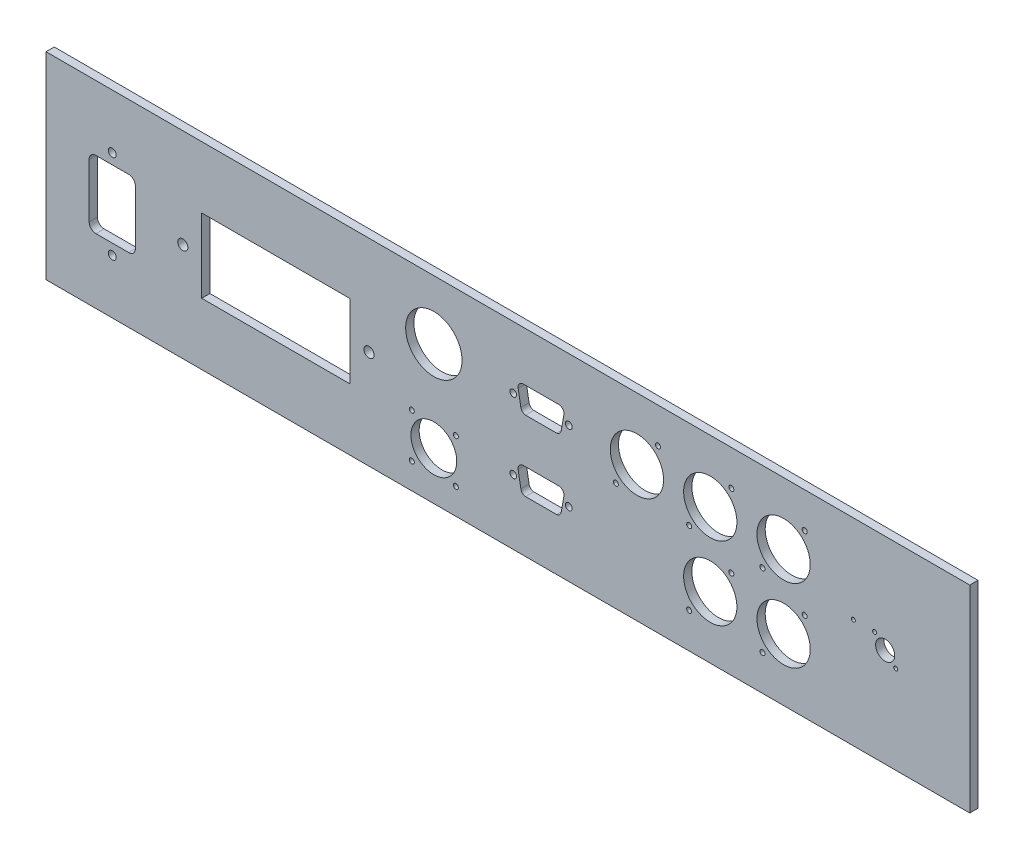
SolidWorks part; units mm, degrees
ref_plane "Front Plane" through (0, 0, 0) normal (0, 0, 1) x (1, 0, 0)
ref_plane "Top Plane" through (0, 0, 0) normal (0, 1, 0) x (1, 0, 0)
ref_plane "Right Plane" through (0, 0, 0) normal (1, 0, 0) x (0, 0, -1)
sketch "Sketch1" plane through (0, 0, 0) normal (0, 0, 1) x (1, 0, 0)
  line L1 (-207.9625, 44.45) -> (207.9625, 44.45)
  line L2 (-207.9625, 44.45) -> (-207.9625, -44.45)
  line L3 (-207.9625, -44.45) -> (207.9625, -44.45)
  line L4 (207.9625, 44.45) -> (207.9625, -44.45)
  line L5 (-207.9625, 44.45) -> (207.9625, -44.45) construction
  line L6 (-207.9625, -44.45) -> (207.9625, 44.45) construction
  point P0 (0, 0)
  dimension "D1" = 88.9
  dimension "D2" = 415.925
extrude "Boss-Extrude1" add sketch "Sketch1" along normal blind 3.7084
sketch "Sketch2" plane through (0, 0, 0) normal (0, 0, -1) x (-1, 0, 0)
  line L0 (-207.9625, 0) -> (207.2005, 0) construction
  line L1 (-207.9625, -44.45) -> (-207.9625, 44.45) construction
  line L2 (207.2005, 44.45) -> (207.2005, -44.45) construction
  circle A0 centre (-169.8625, 0) radius 4.3053
  dimension "D1" = 8.6106
  dimension "D2" = 38.1
extrude "Cut-Extrude1" cut sketch "Sketch2" against normal through all
hole_wizard "#2-56 Tapped Hole1" positions "Sketch3" profile "Sketch4" tap size "#2-56" standard "ANSI Inch"
sketch "Sketch3" plane through (0, 0, 0) normal (0, 0, -1) x (-1, 0, 0)
  line L0 (207.9625, -44.45) -> (-207.9625, -44.45) construction
  point P0 (-174.6123, -4.7498)
  point P3 (-165.1125, 4.75)
  point P7 (-155.5875, 4.75)
  dimension "D1" = 9.525
  dimension "D2" = 49.2
sketch "Sketch4" plane through (174.6123, -4.7498, 0) normal (1, 0, 0) x (0, 1, 0)
  line L0 (0, 0) -> (0, 3.7084)
  line L1 (0, 3.7084) -> (0.889, 3.7084)
  line L2 (0.889, 3.7084) -> (0.889, 0)
  line L5 (0.889, 0) -> (0, 0)
  line L11 (0, -6.35) -> (0, 107.95) construction
  dimension "Thru Tap Drill Dia." = 1.778
  dimension "Thru Tap Drill Depth" = 3.7084
sketch "Sketch5" plane through (0, 0, 0) normal (0, 0, -1) x (-1, 0, 0)
  line L0 (-207.9625, 0) -> (207.9625, 0) construction
  line L1 (-207.9625, -44.45) -> (-207.9625, 44.45) construction
  line L2 (207.9625, 44.45) -> (207.9625, -44.45) construction
  line L3 (207.9625, -44.45) -> (-207.9625, -44.45) construction
  circle A0 centre (-124.1425, 16.51) radius 12
  dimension "D1" = 24
  dimension "D2" = 83.82
  dimension "D3" = 60.96
extrude "Cut-Extrude2" cut sketch "Sketch5" against normal through all
hole_wizard "#4-40 Tapped Hole1" positions "Sketch6" profile "Sketch7" tap size "#4-40" standard "ANSI Inch"
sketch "Sketch6" plane through (0, 0, 0) normal (0, 0, -1) x (-1, 0, 0)
  line L2 (-124.1425, 28.51) -> (-124.1425, 4.51) construction
  line L4 (-136.1425, 16.51) -> (-112.1425, 16.51) construction
  circle A0 centre (-124.1425, 16.51) radius 12 construction
  point P0 (-133.6425, 28.51)
  point P2 (-114.6425, 4.51)
  dimension "D1" = 9.5
  dimension "D2" = 12
  dimension "D3" = 12
  dimension "D4" = 9.5
sketch "Sketch7" plane through (133.6425, 28.51, 0) normal (1, 0, 0) x (0, 1, 0)
  line L0 (0, 0) -> (0, 3.7084)
  line L1 (0, 3.7084) -> (1.1303, 3.7084)
  line L2 (1.1303, 3.7084) -> (1.1303, 0)
  line L5 (1.1303, 0) -> (0, 0)
  line L11 (0, -6.35) -> (0, 107.95) construction
  dimension "Thru Tap Drill Dia." = 2.2606
  dimension "Thru Tap Drill Depth" = 3.7084
pattern_linear "LPattern2" count 2 spacing 33.02 along (0, -1, 0) count 3 spacing 33.02 along (-1, 0, 0) of "Cut-Extrude2", "#4-40 Tapped Hole1"
sketch "Sketch10" plane through (0, 0, 0) normal (0, 0, -1) x (-1, 0, 0)
  line L0 (-14.9225, 23.4991) -> (-14.9225, 9.7875) construction
  line L1 (-6.7326, 22.3272) -> (-23.1124, 22.3272)
  line L2 (-7.9125, 10.6916) -> (-21.9325, 10.6916)
  line L3 (-25.224, 19.5371) -> (-24.0101, 12.6528)
  line L4 (-4.621, 19.5371) -> (-5.8349, 12.6528)
  line L5 (-25.2603, 19.9517) -> (-25.2603, 9.8357) construction
  line L7 (-14.9225, 27.6584) -> (-14.9225, -4.1962) construction
  line L8 (-207.9625, -44.45) -> (-207.9625, 44.45) construction
  line L9 (-58.1025, 16.51) -> (51.5802, 16.51) construction
  arc A0 (-23.1124, 22.3272) -> (-25.224, 19.5371) centre (-22.8727, 19.9517) ccw
  arc A1 (-24.0101, 12.6528) -> (-21.9325, 10.6916) centre (-21.6535, 13.0683) ccw
  circle A2 centre (-27.4193, 16.51) radius 1.524
  arc A3 (-5.8349, 12.6528) -> (-7.9125, 10.6916) centre (-8.1915, 13.0683) cw
  circle A4 centre (-2.4257, 16.51) radius 1.524
  arc A5 (-6.7326, 22.3272) -> (-4.621, 19.5371) centre (-6.9723, 19.9517) cw
  point P9 (-14.9225, 10.6916)
  point P19 (-14.9225, 22.3272)
  dimension "D5" = 3.048
  dimension "D6" = 2.3876
  dimension "D4" = 10
  dimension "D1" = 7.9502
  dimension "D2" = 6.731
  dimension "D3" = 12.4968
  dimension "D7" = 3.4417
  dimension "D8" = 193.04
  dimension "D9" = 3.4417
  dimension "D10" = 11.6356
  dimension "D11" = 5.8172
extrude "Cut-Extrude3" cut sketch "Sketch10" against normal through all and the other way through all
pattern_linear "LPattern3" count 2 spacing 31.75 along (0, -1, 0) of "Cut-Extrude3"
sketch "Sketch11" plane through (0, 0, 0) normal (0, 0, -1) x (-1, 0, 0)
  line L0 (207.9625, 0) -> (-207.9625, 0) construction
  line L1 (207.9625, 44.45) -> (207.9625, -44.45) construction
  line L2 (-207.9625, -44.45) -> (-207.9625, 44.45) construction
  line L3 (207.9625, -44.45) -> (-207.9625, -44.45) construction
  circle A0 centre (33.3375, 17.78) radius 12.7
  dimension "D1" = 241.3
  dimension "D2" = 62.23
extrude "Cut-Extrude4" cut sketch "Sketch11" against normal through all
sketch "Sketch12" plane through (0, 0, 0) normal (0, 0, -1) x (-1, 0, 0)
  line L0 (207.9625, 0) -> (-207.9625, 0) construction
  line L1 (207.9625, 44.45) -> (207.9625, -44.45) construction
  line L2 (-207.9625, -44.45) -> (-207.9625, 44.45) construction
  line L3 (207.9625, -44.45) -> (-207.9625, -44.45) construction
  circle A0 centre (33.3375, -22.86) radius 10.3251
  dimension "D1" = 20.6502
  dimension "D2" = 241.3
  dimension "D3" = 21.59
extrude "Cut-Extrude5" cut sketch "Sketch12" against normal through all
hole_wizard "#4-40 Tapped Hole2" positions "Sketch13" profile "Sketch14" tap size "#4-40" standard "ANSI Inch"
sketch "Sketch13" plane through (0, 0, 0) normal (0, 0, -1) x (-1, 0, 0)
  line L0 (23.4188, -12.9413) -> (43.2562, -12.9413) construction
  line L1 (43.2562, -12.9413) -> (43.2562, -32.7787) construction
  line L2 (43.2562, -32.7787) -> (23.4188, -32.7787) construction
  line L3 (23.4188, -32.7787) -> (23.4188, -12.9413) construction
  line L5 (23.0124, -22.86) -> (43.6626, -22.86) construction
  line L7 (33.3375, -12.5349) -> (33.3375, -33.1851) construction
  circle A0 centre (33.3375, -22.86) radius 10.3251 construction
  point P0 (23.4188, -12.9413)
  point P2 (43.2562, -12.9413)
  point P4 (43.2562, -32.7787)
  point P6 (23.4188, -32.7787)
  dimension "D1" = 9.9187
  dimension "D2" = 9.9187
  dimension "D3" = 9.9187
  dimension "D4" = 9.9187
sketch "Sketch14" plane through (-23.4188, -12.9413, 0) normal (1, 0, 0) x (0, 1, 0)
  line L0 (0, 0) -> (0, 3.7084)
  line L1 (0, 3.7084) -> (1.1303, 3.7084)
  line L2 (1.1303, 3.7084) -> (1.1303, 0)
  line L5 (1.1303, 0) -> (0, 0)
  line L11 (0, -6.35) -> (0, 107.95) construction
  dimension "Thru Tap Drill Dia." = 2.2606
  dimension "Thru Tap Drill Depth" = 3.7084
sketch "Sketch15" plane through (0, 0, 0) normal (0, 0, -1) x (-1, 0, 0)
  line L1 (104.4575, 34.2818) -> (104.4575, -29.2447) construction
  line L6 (-207.9625, -44.45) -> (-207.9625, 44.45) construction
  line L7 (167.7035, -12.192) -> (167.7035, 12.192)
  line L8 (170.7515, -15.24) -> (185.4835, -15.24)
  line L9 (188.5315, -12.192) -> (188.5315, 12.192)
  line L10 (170.7515, 15.24) -> (185.4835, 15.24)
  line L11 (167.7035, -15.24) -> (188.5315, 15.24) construction
  line L12 (188.5315, -15.24) -> (167.7035, 15.24) construction
  line L14 (178.1175, -21.1401) -> (178.1175, 23.6672) construction
  line L16 (-207.9625, 0) -> (207.9625, 0) construction
  line L17 (71.0565, 16.637) -> (137.8585, 16.637)
  line L18 (71.0565, 16.637) -> (71.0565, -16.637)
  line L19 (71.0565, -16.637) -> (137.8585, -16.637)
  line L20 (137.8585, 16.637) -> (137.8585, -16.637)
  line L21 (71.0565, 16.637) -> (137.8585, -16.637) construction
  line L22 (71.0565, -16.637) -> (137.8585, 16.637) construction
  line L23 (207.9625, 44.45) -> (207.9625, -44.45) construction
  arc A5 (185.4835, -15.24) -> (188.5315, -12.192) centre (185.4835, -12.192) ccw
  arc A6 (188.5315, 12.192) -> (185.4835, 15.24) centre (185.4835, 12.192) ccw
  arc A7 (167.7035, 12.192) -> (170.7515, 15.24) centre (170.7515, 12.192) cw
  arc A8 (167.7035, -12.192) -> (170.7515, -15.24) centre (170.7515, -12.192) ccw
  circle A9 centre (178.1175, 20.0025) radius 1.778
  circle A11 centre (146.3675, 0) radius 2.286
  circle A12 centre (62.5475, 0) radius 2.286
  circle A13 centre (178.1175, -20.0025) radius 1.778
  point P1 (178.1175, 0)
  point P33 (104.4575, 0)
  dimension "D5" = 3.048
  dimension "D9" = 20.0025
  dimension "D10" = 3.556
  dimension "D8" = 4.572
  dimension "D7" = 33.401
  dimension "D2" = 386.08
  dimension "D3" = 20.828
  dimension "D4" = 30.48
  dimension "D6" = 312.42
  dimension "D11" = 41.91
  dimension "D12" = 66.802
  dimension "D13" = 33.274
extrude "Cut-Extrude6" cut sketch "Sketch15" against normal through all
sketch "Sketch16" plane through (0, 0, 0) normal (0, 0, -1) x (-1, 0, 0)
  text T0 "FIBER IN"
  text T1 "SDI 1"
  text T2 "SDI 2"
  text T3 "MONITOR"
  text T4 "NAVPROC"
  text T5 "FOCAL DIAG."
  text T6 "SONY LAN"
  text T7 "LAPBOX"
extrude "Cut-Extrude7" cut sketch "Sketch16" against normal blind 1.27
